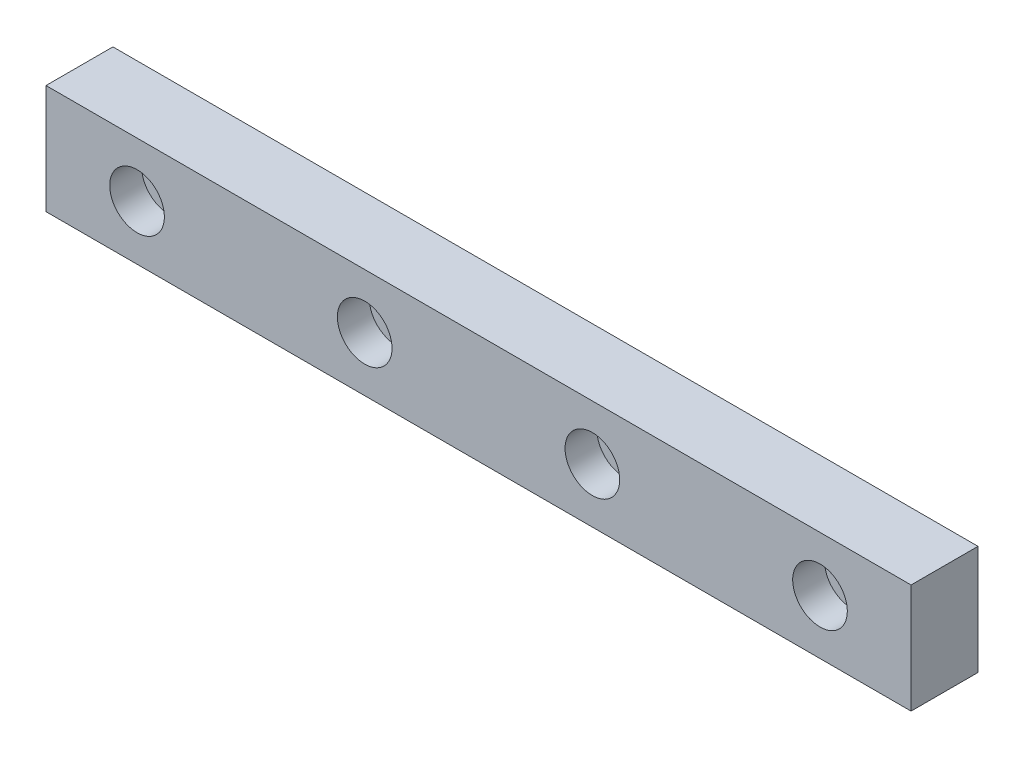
SolidWorks part; units mm, degrees
ref_plane "前视基准面" through (0, 0, 0) normal (0, 0, 1) x (1, 0, 0)
ref_plane "上视基准面" through (0, 0, 0) normal (0, 1, 0) x (1, 0, 0)
ref_plane "右视基准面" through (0, 0, 0) normal (1, 0, 0) x (0, 0, -1)
sketch "草图1" plane through (0, 0, 0) normal (0, 0, 1) x (1, 0, 0)
  line L0 (0, 12) -> (0, 0)
  line L1 (95, 12) -> (95, 0)
  line L2 (0, 0) -> (95, 0)
  line L3 (0, 12) -> (95, 12)
  circle A0 centre (85, 6) radius 1.75
  circle A1 centre (10, 6) radius 1.75
  circle A2 centre (35, 6) radius 1.75
  circle A3 centre (60, 6) radius 1.75
extrude "凸台-拉伸1" add sketch "草图1" along normal blind 7.35
sketch "草图2" plane through (0, 0, 7.35) normal (0, 0, 1) x (1, 0, 0)
  circle A0 centre (85, 6) radius 3
  circle A1 centre (10, 6) radius 3
  circle A2 centre (35, 6) radius 3
  circle A3 centre (60, 6) radius 3
extrude "切除-拉伸1" cut sketch "草图2" against normal blind 3.5
